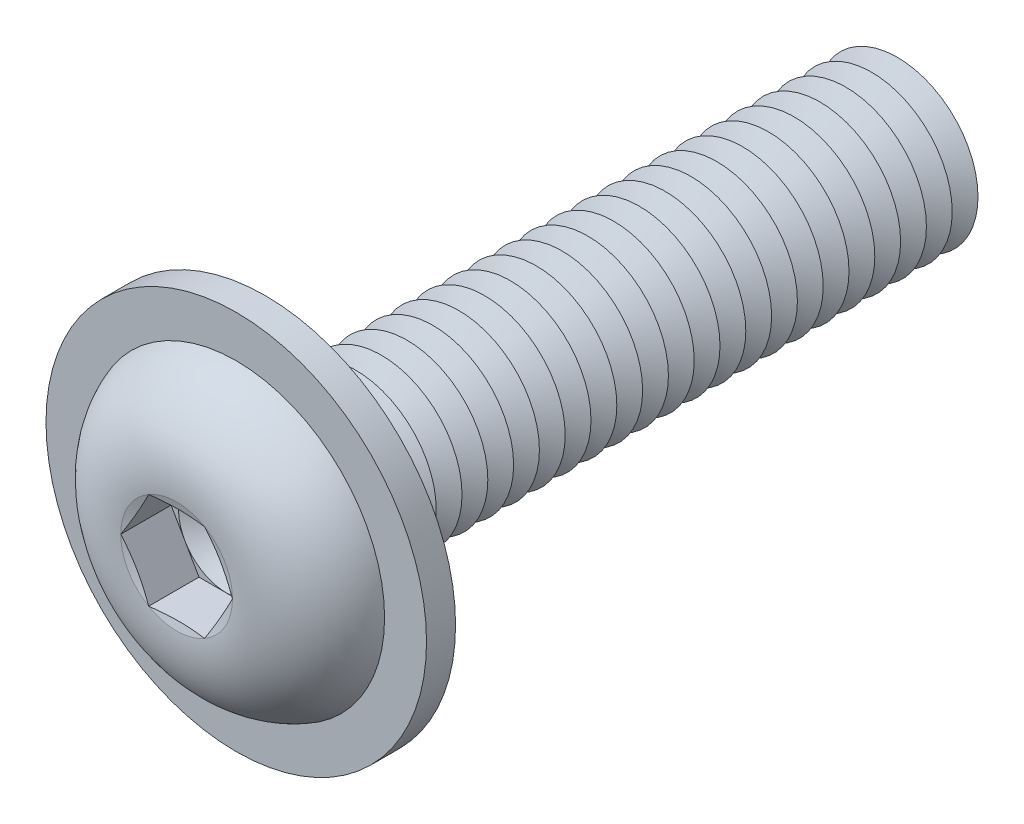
SolidWorks part; units mm, degrees
ref_plane "Front Plane" through (0, 0, 0) normal (0, 0, 1) x (1, 0, 0)
ref_plane "Top Plane" through (0, 0, 0) normal (0, 1, 0) x (1, 0, 0)
ref_plane "Right Plane" through (0, 0, 0) normal (1, 0, 0) x (0, 0, -1)
sketch "Sketch1" plane through (0, 0, 0) normal (1, 0, 0) x (0, 0, -1)
  line L0 (0, 2.5) -> (0, 4.75)
  line L3 (0, 2.5) -> (20, 2.5)
  line L4 (20, 2.5) -> (20, 0)
  line L5 (20, 0) -> (-2.75, 0) construction
  line L6 (-2.75, 0) -> (20, 0)
  line L7 (-2.75, 1.732) -> (-2.75, 0.866) construction
  line L8 (-2.75, 0.866) -> (-2.75, 0)
  line L9 (-2.75, 1.732) -> (-2.5179, 0.866)
  line L10 (-2.5179, 0.866) -> (-2.75, 0.866)
  line L11 (20, 0) -> (22.7481, 0) construction
  line L12 (0, 4.75) -> (-2.75, 4.75) construction
  arc A1 (0, 4.75) -> (-2.75, 1.732) centre (0, 1.9881) ccw
  point P8 (20, 1.25)
  dimension "D1" = 9.5
  dimension "D2" = 5
  dimension "D3" = 2.75
  dimension "D4" = 3.4641
  dimension "D5" = 20
  dimension "D6" = 15
revolve "Revolve1" add sketch "Sketch1" angle 360 about L5
fillet "Fillet1" radius 0.4 1 edges at (-2.5, 0, 0)
sketch "Sketch2" plane through (0, 0, 0) normal (1, 0, 0) x (0, 0, -1)
  line L0 (19.6, 2.5) -> (20.4, 2.5)
  line L1 (20, 2.5) -> (0.4, 2.5) construction
  line L2 (20.4, 2.5) -> (20, 1.8072)
  line L3 (20, -2.5) -> (20, 2.5) construction
  line L4 (20, 1.8072) -> (19.6, 2.5)
  dimension "D1" = 0.8
revolve "Cut-Revolve1" cut sketch "Sketch2" angle 360 about axis through (0, 0, -20) along (0, 0, -1)
pattern_linear "LPattern1" count 25 spacing 0.8 along (0, 0, 1) of "Cut-Revolve1"
sketch "Sketch3" plane through (0, 0, 2.75) normal (0, 0, 1) x (1, 0, 0)
  line L7 (0.866, 1.5) -> (-0.866, 1.5)
  line L8 (-0.866, 1.5) -> (-1.7321, 0)
  line L9 (-1.7321, 0) -> (-0.866, -1.5)
  line L10 (-0.866, -1.5) -> (0.866, -1.5)
  line L11 (0.866, -1.5) -> (1.732, 0)
  line L12 (1.732, 0) -> (0.866, 1.5)
  circle A0 centre (0, 0) radius 1.5 construction
  circle A3 centre (0, 0) radius 1.7321 construction
extrude "Cut-Extrude1" cut sketch "Sketch3" against normal blind 1.56
sketch "Sketch4" plane through (0, 0, 1.19) normal (0, 0, 1) x (1, 0, 0)
  line L1 (0.866, 1.5) -> (-0.866, 1.5) construction
  circle A0 centre (0, 0) radius 1.5
extrude "Cut-Extrude2" cut sketch "Sketch4" against normal through all draft 60
sketch "Sketch5" plane through (0, 0, 0) normal (0, 0, -1) x (-1, 0, 0)
  circle A0 centre (0, 0) radius 5.9
  circle A1 centre (0, 0) radius 2.9
  circle A2 centre (0, 0) radius 2.9 construction
  dimension "D1" = 11.8
extrude "Boss-Extrude1" add sketch "Sketch5" against normal blind 0.9
